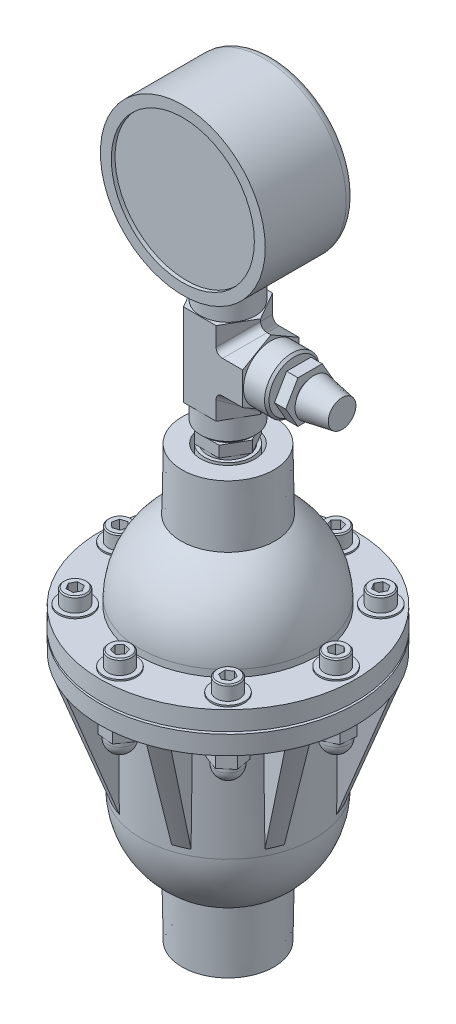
SolidWorks part; units mm, degrees
ref_plane "Front Plane" through (0, 0, 0) normal (0, 0, 1) x (1, 0, 0)
ref_plane "Top Plane" through (0, 0, 0) normal (0, 1, 0) x (1, 0, 0)
ref_plane "Right Plane" through (0, 0, 0) normal (1, 0, 0) x (0, 0, -1)
sketch "Sketch1" plane through (0, 0, 0) normal (0, 1, 0) x (1, 0, 0)
  circle A0 centre (0, 0) radius 43.2435
  dimension "D1" = 86.487
extrude "Extrude1" add sketch "Sketch1" along normal blind 6.35 draft 1
sketch "Sketch2" plane through (0, 0, 0) normal (0, 1, 0) x (1, 0, 0)
  circle A0 centre (0, 0) radius 29.972
  dimension "D1" = 59.944
extrude "Extrude2" add sketch "Sketch2" along normal blind 37.338 draft 1
fillet "Fillet1" radius 29.21 1 edges at (0, 37.338, 29.3203)
ref_plane "Plane1" through (0, 53.6702, 0) normal (0, 1, 0) x (-1, 0, 0)
sketch "Sketch3" plane through (0, 53.6702, 0) normal (0, 1, 0) x (-1, 0, 0)
  circle A0 centre (0, 0) radius 15.494
  dimension "D1" = 30.988
extrude "Extrude3" add sketch "Sketch3" against normal up to surface (53.6702 mm away) draft 1
sketch "Sketch4" plane through (0, 53.6702, 0) normal (0, 1, 0) x (-1, 0, 0)
  circle A0 centre (0, 0) radius 9.144
  circle A1 centre (0, 0) radius 8.001
  dimension "D1" = 18.288
  dimension "D2" = 1.143
extrude "Extrude4" cut sketch "Sketch4" against normal blind 16.637 draft 1
hole_wizard "1/4 NPT Tapped Hole1" positions "Sketch6" profile "Sketch5" size "1/4" standard "Ansi Inch"
sketch "Sketch6" plane through (0, 53.6702, 0) normal (0, 1, 0) x (-1, 0, 0)
  point P0 (0, 0)
sketch "Sketch5" plane through (0, 53.6702, 0) normal (1, 0, 0) x (0, 0, 1)
  line L0 (0, 0) -> (0, 20.3603)
  line L1 (5.5626, 17.018) -> (0, 20.3603)
  line L2 (-5.5626, 17.018) -> (0, 20.3603) construction
  line L3 (5.5626, 17.018) -> (5.5626, 9.906)
  line L4 (5.5626, 9.906) -> (6.558, 9.906)
  line L5 (6.558, 9.906) -> (6.8546, 0)
  line L6 (-6.558, 9.906) -> (-6.8546, 0) construction
  line L7 (6.8546, 0) -> (0, 0)
  line L8 (0, -6.35) -> (0, 107.95) construction
  line L11 (-5.5626, 9.906) -> (-6.558, 9.906) construction
  dimension "Tap Drill Dia." = 11.1252
  dimension "Tap Drill Depth" = 17.018
  dimension "Thread Dia." = 13.7092
  dimension "Thread Angle" = 3.43
  dimension "Thread Depth" = 9.906
  dimension "Drill Angle" = 118
ref_plane "Plane2" through (0, -0.762, 0) normal (0, 1, 0) x (-1, 0, 0)
sketch "Sketch7" plane through (0, -0.762, 0) normal (0, 1, 0) x (-1, 0, 0)
  circle A0 centre (0, 0) radius 43.2435
  dimension "D1" = 86.487
extrude "Extrude5" add sketch "Sketch7" against normal blind 6.35 draft 1
sketch "Sketch8" plane through (0, -0.762, 0) normal (0, 1, 0) x (-1, 0, 0)
  circle A0 centre (0, 0) radius 32.4866
  dimension "D1" = 64.9732
extrude "Extrude6" add sketch "Sketch8" along normal blind 6.35
sketch "Sketch9" plane through (0, -0.762, 0) normal (0, 1, 0) x (-1, 0, 0)
  circle A0 centre (0, 0) radius 29.972
  dimension "D1" = 59.944
extrude "Extrude7" add sketch "Sketch9" against normal blind 74.422 draft 1
fillet "Fillet3" radius 28.448 1 edges at (0, -75.184, 28.673)
ref_plane "Plane4" through (0, -91.567, 0) normal (0, 1, 0) x (-1, 0, 0)
sketch "Sketch14" plane through (0, -91.567, 0) normal (0, 1, 0) x (-1, 0, 0)
  circle A0 centre (0, 0) radius 15.494
  dimension "D1" = 30.988
extrude "Extrude9" add sketch "Sketch14" along normal up to surface (97.917 mm away) draft 1
hole_wizard "1/2 NPT Tapped Hole2" positions "Sketch16" profile "Sketch15" size "1/2" standard "Ansi Inch"
sketch "Sketch16" plane through (0, -91.567, 0) normal (0, 1, 0) x (-1, 0, 0)
  point P0 (0, 0)
sketch "Sketch15" plane through (0, -91.567, 0) normal (1, 0, 0) x (0, 0, -1)
  line L0 (0, 0) -> (0, 27.9705)
  line L1 (8.9281, 22.606) -> (0, 27.9705)
  line L2 (-8.9281, 22.606) -> (0, 27.9705) construction
  line L3 (8.9281, 22.606) -> (8.9281, 13.462)
  line L4 (8.9281, 13.462) -> (10.2617, 13.462)
  line L5 (10.2617, 13.462) -> (10.6647, 0)
  line L6 (-10.2617, 13.462) -> (-10.6647, 0) construction
  line L7 (10.6647, 0) -> (0, 0)
  line L8 (0, -6.35) -> (0, 107.95) construction
  line L11 (-8.9281, 13.462) -> (-10.2617, 13.462) construction
  dimension "Tap Drill Dia." = 17.8562
  dimension "Tap Drill Depth" = 22.606
  dimension "Thread Dia." = 21.3295
  dimension "Thread Angle" = 3.43
  dimension "Thread Depth" = 13.462
  dimension "Drill Angle" = 118
ref_plane "Plane5" through (0, -7.112, 0) normal (0, 1, 0) x (-1, 0, 0)
sketch "Sketch17" plane through (0, -7.112, 0) normal (0, 1, 0) x (-1, 0, 0)
  line L0 (0, 0) -> (-43.2435, 0) construction
  line L1 (0, 0) -> (-39.9518, 16.5486) construction
  line L2 (-22.9163, 12.9288) -> (-41.6063, 20.6705) construction
  line L3 (-25.3209, 7.0517) -> (-44.9604, 15.1866) construction
  line L4 (-25.3209, 7.0517) -> (-22.9163, 12.9288)
  line L5 (-22.9163, 12.9288) -> (-38.6289, 19.4372)
  line L6 (-25.3209, 7.0517) -> (-41.059, 13.5706)
  circle A0 centre (0, 0) radius 43.2435 construction
  arc A2 (-41.059, 13.5706) -> (-38.6289, 19.4372) centre (0, 0) cw
  dimension "D1" = 22.5
  dimension "D2" = 3.175
  dimension "D3" = 3.175
extrude "Extrude10" add sketch "Sketch17" against normal blind 38.1 draft 1
pattern_circular "CirPattern1" count 8 over 360 about axis through (0, 0, 0) along (0, 1, 0) of "Extrude10"
sketch "Sketch18" plane through (0, 0, 0) normal (1, 0, 0) x (0, 0, -1)
  line L0 (-43.1327, -7.112) -> (-29.1961, -45.212)
  line L2 (-29.8612, -7.112) -> (-29.1609, -47.2325) construction
  line L3 (-29.1961, -45.212) -> (-32.8286, -50.1137)
  line L4 (-32.8286, -50.1137) -> (-54.9992, -50.1137)
  line L5 (-54.9992, -50.1137) -> (-46.7266, -7.112)
  line L6 (43.2435, -0.762) -> (-43.2435, -0.762) construction
  line L7 (-29.8612, -7.112) -> (-29.1609, -47.2325) construction
  line L8 (-43.1327, -7.112) -> (-46.7266, -7.112)
  line L9 (0, 0) -> (0, -91.567) construction
  line L10 (-15.494, -91.567) -> (15.494, -91.567) construction
  dimension "D1" = 44.45
revolve "Cut-Revolve1" cut sketch "Sketch18" angle 360 about L9
ref_plane "Plane6" through (0, 6.35, 0) normal (0, 1, 0) x (-1, 0, 0)
sketch "Sketch19" plane through (0, 6.35, 0) normal (0, 1, 0) x (-1, 0, 0)
  line L0 (0, 0) -> (-43.1327, 0) construction
  circle A0 centre (0, 0) radius 43.1327 construction
  circle A1 centre (0, 0) radius 36.449 construction
  circle A2 centre (-36.449, 0) radius 5.5626
  dimension "D1" = 72.898
  dimension "D2" = 11.1252
extrude "Extrude11" add sketch "Sketch19" along normal blind 0.508
sketch "Sketch20" plane through (0, 6.35, 0) normal (0, 1, 0) x (-1, 0, 0)
  circle A0 centre (-36.449, 0) radius 3.9624
  dimension "D1" = 7.9248
extrude "Extrude12" add sketch "Sketch20" along normal blind 5.334
ref_plane "Plane7" through (0, 11.684, 0) normal (0, 1, 0) x (-1, 0, 0)
sketch "Sketch21" plane through (0, 11.684, 0) normal (0, 1, 0) x (-1, 0, 0)
  line L1 (-38.6337, -0.6786) -> (-36.9537, -2.2313)
  line L2 (-36.9537, -2.2313) -> (-34.7689, -1.5527)
  line L3 (-34.7689, -1.5527) -> (-34.2643, 0.6786)
  line L4 (-34.2643, 0.6786) -> (-35.9443, 2.2313)
  line L5 (-35.9443, 2.2313) -> (-38.1291, 1.5527)
  line L6 (-38.1291, 1.5527) -> (-38.6337, -0.6786)
  circle A0 centre (-36.449, 0) radius 1.9812 construction
extrude "Extrude13" cut sketch "Sketch21" against normal blind 3.175
chamfer "Chamfer1" distance 0.381 angle 45 1 edges at (36.449, 11.684, 3.9624)
sketch "Sketch22" plane through (0, -7.112, 0) normal (0, 1, 0) x (-1, 0, 0)
  circle A0 centre (-36.449, 0) radius 5.5626
extrude "Extrude14" add sketch "Sketch22" against normal blind 0.508
sketch "Sketch23" plane through (0, -7.112, 0) normal (0, 1, 0) x (-1, 0, 0)
  line L1 (-40.7657, 3.0392) -> (-41.2394, -2.2188)
  line L2 (-41.2394, -2.2188) -> (-36.9227, -5.258)
  line L3 (-36.9227, -5.258) -> (-32.1323, -3.0392)
  line L4 (-32.1323, -3.0392) -> (-31.6586, 2.2188)
  line L5 (-31.6586, 2.2188) -> (-35.9753, 5.258)
  line L6 (-35.9753, 5.258) -> (-40.7657, 3.0392)
  circle A0 centre (-36.449, 0) radius 4.572 construction
extrude "Extrude15" add sketch "Sketch23" against normal blind 5.334
sketch "Sketch24" plane through (0, -7.112, 0) normal (0, 1, 0) x (-1, 0, 0)
  circle A0 centre (-36.449, 0) radius 4.318
extrude "Extrude16" add sketch "Sketch24" against normal blind 10.922
fillet "Fillet4" radius 4.191 1 edges at (36.449, -18.034, 4.318)
pattern_circular "CirPattern2" count 8 over 360 about axis through (0, 0, 0) along (0, 1, 0) of "Extrude11", "Extrude12", "Extrude13", "Chamfer1", "Extrude14", "Extrude15", "Extrude16", "Fillet4"
sketch "Sketch25" plane through (0, 0, 0) normal (0, 1, 0) x (1, 0, 0)
  circle A0 centre (0, 0) radius 6.858
  dimension "D1" = 13.716
extrude "Boss-Extrude1" add sketch "Sketch25" along normal blind 132.334
sketch "Sketch26" plane through (0, 0, 0) normal (0, 0, 1) x (1, 0, 0)
  line L0 (6.858, 132.334) -> (-6.858, 132.334) construction
  circle A0 centre (0, 132.334) radius 27.813
  dimension "D1" = 55.626
extrude "Boss-Extrude2" add sketch "Sketch26" along normal mid plane 30.48
ref_plane "Plane10" through (0, 60.0202, 0) normal (0, 1, 0) x (-1, 0, 0)
ref_plane "Plane11" through (0, 54.9402, 0) normal (0, 1, 0) x (-1, 0, 0)
sketch "Sketch29" plane through (0, 54.9402, 0) normal (0, 1, 0) x (-1, 0, 0)
  line L1 (-8.2122, 0) -> (-4.1061, -7.112)
  line L2 (-4.1061, -7.112) -> (4.1061, -7.112)
  line L3 (4.1061, -7.112) -> (8.2122, 0)
  line L4 (8.2122, 0) -> (4.1061, 7.112)
  line L5 (4.1061, 7.112) -> (-4.1061, 7.112)
  line L6 (-4.1061, 7.112) -> (-8.2122, 0)
  circle A0 centre (0, 0) radius 7.112 construction
extrude "Boss-Extrude5" add sketch "Sketch29" along normal blind 3.81
sketch "Sketch30" plane through (0, 60.0202, 0) normal (0, 1, 0) x (-1, 0, 0)
  circle A0 centre (0, 0) radius 9.271
  dimension "D1" = 18.542
extrude "Boss-Extrude6" add sketch "Sketch30" along normal blind 43.18
ref_plane "Plane12" through (0, 67.6402, 0) normal (0, 1, 0) x (-1, 0, 0)
sketch "Sketch31" plane through (0, 67.6402, 0) normal (0, 1, 0) x (-1, 0, 0)
  line L1 (-10.9985, 0) -> (-5.4993, -9.525)
  line L2 (-5.4993, -9.525) -> (5.4993, -9.525)
  line L3 (5.4993, -9.525) -> (10.9985, 0)
  line L4 (10.9985, 0) -> (5.4993, 9.525)
  line L5 (5.4993, 9.525) -> (-5.4993, 9.525)
  line L6 (-5.4993, 9.525) -> (-10.9985, 0)
  circle A0 centre (0, 0) radius 9.525 construction
extrude "Boss-Extrude8" add sketch "Sketch31" along normal blind 27.94
ref_plane "Plane13" through (14.478, 0, 0) normal (1, 0, 0) x (0, 0, -1)
ref_plane "Plane14" through (22.352, 0, 0) normal (1, 0, 0) x (0, 0, -1)
sketch "Sketch32" plane through (14.478, 0, 0) normal (1, 0, 0) x (0, 0, -1)
  line L0 (0, 95.5802) -> (0, 67.6402) construction
  line L1 (0, 92.6087) -> (-9.525, 87.1095)
  line L2 (-9.525, 87.1095) -> (-9.525, 76.1109)
  line L3 (-9.525, 76.1109) -> (0, 70.6117)
  line L4 (0, 70.6117) -> (9.525, 76.1109)
  line L5 (9.525, 76.1109) -> (9.525, 87.1095)
  line L6 (9.525, 87.1095) -> (0, 92.6087)
  circle A0 centre (0, 81.6102) radius 9.525 construction
extrude "Boss-Extrude9" add sketch "Sketch32" against normal blind 14.986
sketch "Sketch33" plane through (22.352, 0, 0) normal (1, 0, 0) x (0, 0, -1)
  line L0 (0, 95.5802) -> (0, 67.6402) construction
  circle A0 centre (0, 81.6102) radius 9.271
  dimension "D1" = 18.542
extrude "Boss-Extrude10" add sketch "Sketch33" against normal blind 14.986
ref_plane "Plane15" through (27.686, 0, 0) normal (1, 0, 0) x (0, 0, -1)
sketch "Sketch34" plane through (27.686, 0, 0) normal (1, 0, 0) x (0, 0, -1)
  line L0 (0, 95.5802) -> (0, 67.6402) construction
  circle A0 centre (0, 81.6102) radius 6.858
  dimension "D1" = 13.716
extrude "Boss-Extrude11" add sketch "Sketch34" against normal blind 3.81 separate body
sketch "Sketch35" plane through (27.686, 0, 0) normal (1, 0, 0) x (0, 0, -1)
  line L0 (0, 95.5802) -> (0, 67.6402) construction
  line L1 (-8.2122, 81.6102) -> (-4.1061, 74.4982)
  line L2 (-4.1061, 74.4982) -> (4.1061, 74.4982)
  line L3 (4.1061, 74.4982) -> (8.2122, 81.6102)
  line L4 (8.2122, 81.6102) -> (4.1061, 88.7222)
  line L5 (4.1061, 88.7222) -> (-4.1061, 88.7222)
  line L6 (-4.1061, 88.7222) -> (-8.2122, 81.6102)
  circle A0 centre (0, 81.6102) radius 7.112 construction
extrude "Boss-Extrude12" add sketch "Sketch35" against normal blind 3.81
ref_plane "Plane17" through (28.956, 0, 0) normal (1, 0, 0) x (0, 0, -1)
sketch "Sketch38" plane through (28.956, 0, 0) normal (1, 0, 0) x (0, 0, -1)
  line L0 (0, 95.5802) -> (0, 67.6402) construction
  circle A0 centre (0, 81.6102) radius 4.7625
  dimension "D1" = 9.525
extrude "Boss-Extrude14" add sketch "Sketch38" against normal blind 9.525
sketch "Sketch39" plane through (28.956, 0, 0) normal (1, 0, 0) x (0, 0, -1)
  line L0 (0, 95.5802) -> (0, 67.6402) construction
  circle A0 centre (0, 81.6102) radius 6.35
  dimension "D1" = 12.7
extrude "Boss-Extrude15" add sketch "Sketch39" along normal blind 9.525 draft 10
ref_plane "Plane18" through (0, 0, 15.24) normal (0, 0, 1) x (1, 0, 0)
sketch "Sketch40" plane through (0, 0, 15.24) normal (0, 0, 1) x (1, 0, 0)
  circle A0 centre (0, 132.334) radius 24.13
  dimension "D1" = 48.26
extrude "Cut-Extrude1" cut sketch "Sketch40" against normal blind 1.27
fillet "Fillet5" radius 2.54 4 edges at (8.2489, 73.3613, -4.7625) (8.2489, 73.3613, 4.7625) (8.2489, 89.8591, -4.7625) (8.2489, 89.8591, 4.7625)
fillet "Fillet6" radius 3.175 1 edges at (27.813, 132.334, -15.24)
chamfer "Chamfer2" distance 0.762 angle 45 3 edges at (22.352, 81.6102, -9.271) (0, 60.0202, 9.271) (0, 103.2002, 9.271)
